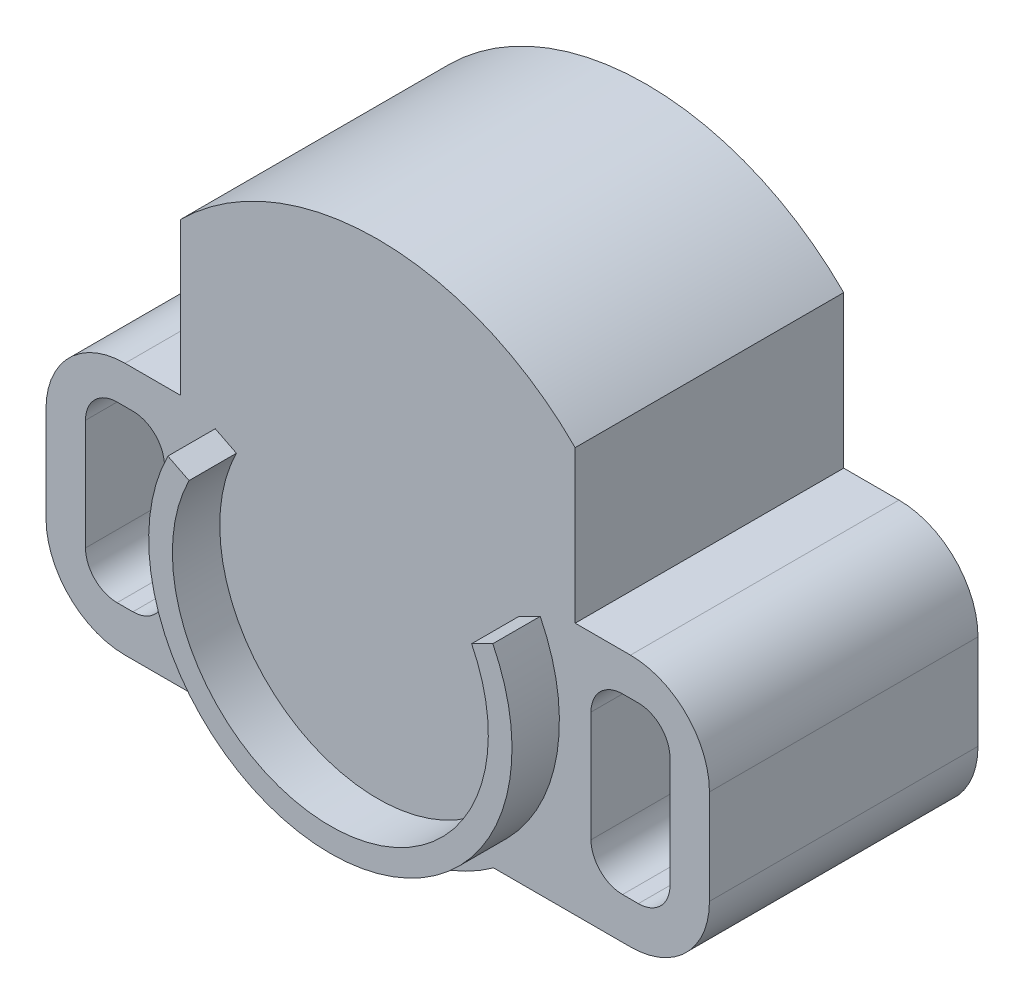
SolidWorks part; units mm, degrees
ref_plane "Plan1" through (0, 0, 0) normal (0, 0, 1) x (1, 0, 0)
ref_plane "Plan2" through (0, 0, 0) normal (0, 1, 0) x (1, 0, 0)
ref_plane "Plan3" through (0, 0, 0) normal (1, 0, 0) x (0, 0, -1)
sketch "Esquisse1" plane through (0, 0, 0) normal (0, 0, 1) x (1, 0, 0)
  line L0 (-16, -10.1244) -> (-7.3312, -10.1244)
  line L1 (16, -10.1244) -> (7.3312, -10.1244)
  line L2 (-21, -5.1244) -> (-21, 0.8756)
  line L3 (-16, 5.8756) -> (-12.5, 5.8756)
  line L4 (21, -5.1244) -> (21, 0.8756)
  line L5 (12.5, 5.8756) -> (16, 5.8756)
  line L8 (-12.5, 5.8756) -> (-12.5, 15.5)
  line L9 (12.5, 5.8756) -> (12.5, 15.5)
  arc A0 (-7.3312, -10.1244) -> (7.3312, -10.1244) centre (0, 0) ccw
  arc A1 (-16, 5.8756) -> (-21, 0.8756) centre (-16, 0.8756) ccw
  arc A2 (21, 0.8756) -> (16, 5.8756) centre (16, 0.8756) ccw
  arc A3 (16, -10.1244) -> (21, -5.1244) centre (16, -5.1244) ccw
  arc A4 (-21, -5.1244) -> (-16, -10.1244) centre (-16, -5.1244) ccw
  arc A5 (-12.5, 15.5) -> (12.5, 15.5) centre (0, 3) cw
  dimension "D1" = 5
extrude "Base-Extrusion" add sketch "Esquisse1" along normal blind 17
sketch "Esquisse2" plane through (0, 0, 17) normal (0, 0, 1) x (1, 0, 0)
  line L0 (-16.5, 3.5) -> (-15.5, 3.5)
  line L1 (15.5, 3.5) -> (16.5, 3.5)
  line L2 (13.5, 1.5) -> (13.5, -5.5)
  line L3 (15.5, -7.5) -> (16.5, -7.5)
  line L4 (18.5, 1.5) -> (18.5, -5.5)
  line L5 (-18.5, 1.5) -> (-18.5, -5.5)
  line L6 (-16.5, -7.5) -> (-15.5, -7.5)
  line L7 (-13.5, 1.5) -> (-13.5, -5.5)
  arc A0 (15.5, 3.5) -> (13.5, 1.5) centre (15.5, 1.5) ccw
  arc A1 (18.5, 1.5) -> (16.5, 3.5) centre (16.5, 1.5) ccw
  arc A2 (16.5, -7.5) -> (18.5, -5.5) centre (16.5, -5.5) ccw
  arc A3 (13.5, -5.5) -> (15.5, -7.5) centre (15.5, -5.5) ccw
  arc A4 (-16.5, 3.5) -> (-18.5, 1.5) centre (-16.5, 1.5) ccw
  arc A5 (-13.5, 1.5) -> (-15.5, 3.5) centre (-15.5, 1.5) ccw
  arc A6 (-15.5, -7.5) -> (-13.5, -5.5) centre (-15.5, -5.5) ccw
  arc A7 (-18.5, -5.5) -> (-16.5, -7.5) centre (-16.5, -5.5) ccw
  dimension "D1" = 2
extrude "Enlèv. mat.-Extru.1" cut sketch "Esquisse2" against normal blind 17
sketch "Esquisse3" plane through (0, 0, 17) normal (0, 0, 1) x (1, 0, 0)
  circle A0 centre (0, 0) radius 11.5
extrude "Boss.-Extru.1" add sketch "Esquisse3" along normal blind 3
sketch "Esquisse4" plane through (0, 0, 20) normal (0, 0, 1) x (1, 0, 0)
  circle A0 centre (0, 0) radius 10
extrude "Enlèv. mat.-Extru.2" cut sketch "Esquisse4" against normal blind 3
sketch "Esquisse5" plane through (0, 0, 20) normal (0, 0, 1) x (1, 0, 0)
  line L1 (-20, 10) -> (0, 0)
  line L2 (0, 0) -> (20, 10)
  arc A0 (-20, 10) -> (20, 10) centre (0, 0) cw
extrude "Enlèv. mat.-Extru.3" cut sketch "Esquisse5" against normal blind 3
